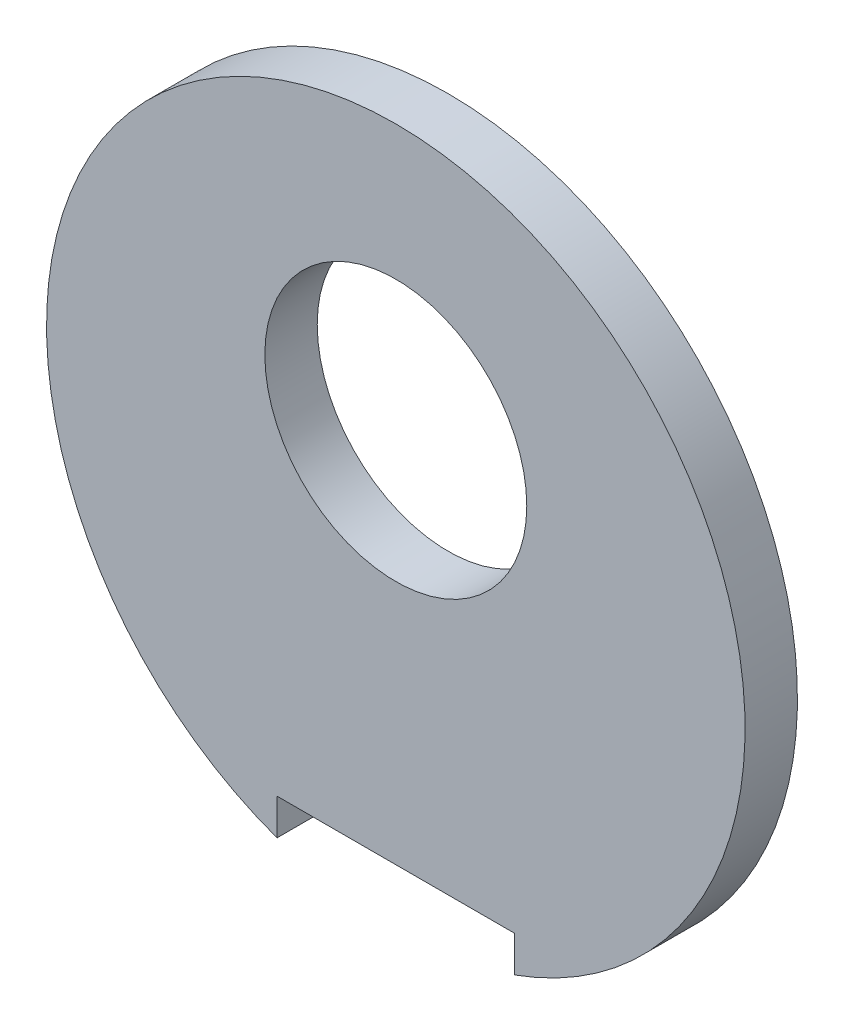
SolidWorks part; units mm, degrees
ref_plane "Front Plane" through (0, 0, 0) normal (0, 0, 1) x (1, 0, 0)
ref_plane "Top Plane" through (0, 0, 0) normal (0, 1, 0) x (1, 0, 0)
ref_plane "Right Plane" through (0, 0, 0) normal (1, 0, 0) x (0, 0, -1)
sketch "Sketch1" plane through (0, 0, 0) normal (0, 0, 1) x (1, 0, 0)
  circle A0 centre (0, 0) radius 25.4
  dimension "D1" = 50.8
extrude "Extrude1" add sketch "Sketch1" along normal blind 3.81
sketch "Sketch2" plane through (0, 0, 0) normal (0, 0, 1) x (1, 0, 0)
  line L0 (0, -28.6592) -> (0, 27.2927) construction
  circle A0 centre (0, 6.096) radius 9.525
  dimension "D2" = 19.05
  dimension "D1" = 6.096
extrude "Cut-Extrude2" cut sketch "Sketch2" along normal through all
sketch "Sketch3" plane through (0, 0, 0) normal (0, 0, 1) x (1, 0, 0)
  line L0 (-8.636, -21.2598) -> (8.636, -21.2598)
  line L1 (0, 25.4) -> (0, -25.4) construction
  line L2 (27.6164, 0) -> (-27.6164, 0) construction
  line L3 (0, 6.096) -> (26.7534, 6.096) construction
  line L4 (0, 6.096) -> (-27.6164, 6.096) construction
  line L5 (-8.636, -21.2598) -> (-8.636, -27.7962)
  line L6 (-8.636, -27.7962) -> (8.636, -27.7962)
  line L7 (8.636, -27.7962) -> (8.636, -21.2598)
  circle A0 centre (0, 0) radius 25.4 construction
  dimension "D1" = 27.3558
  dimension "D2" = 17.272
  dimension "D3" = 8.636
extrude "Cut-Extrude3" cut sketch "Sketch3" along normal through all
